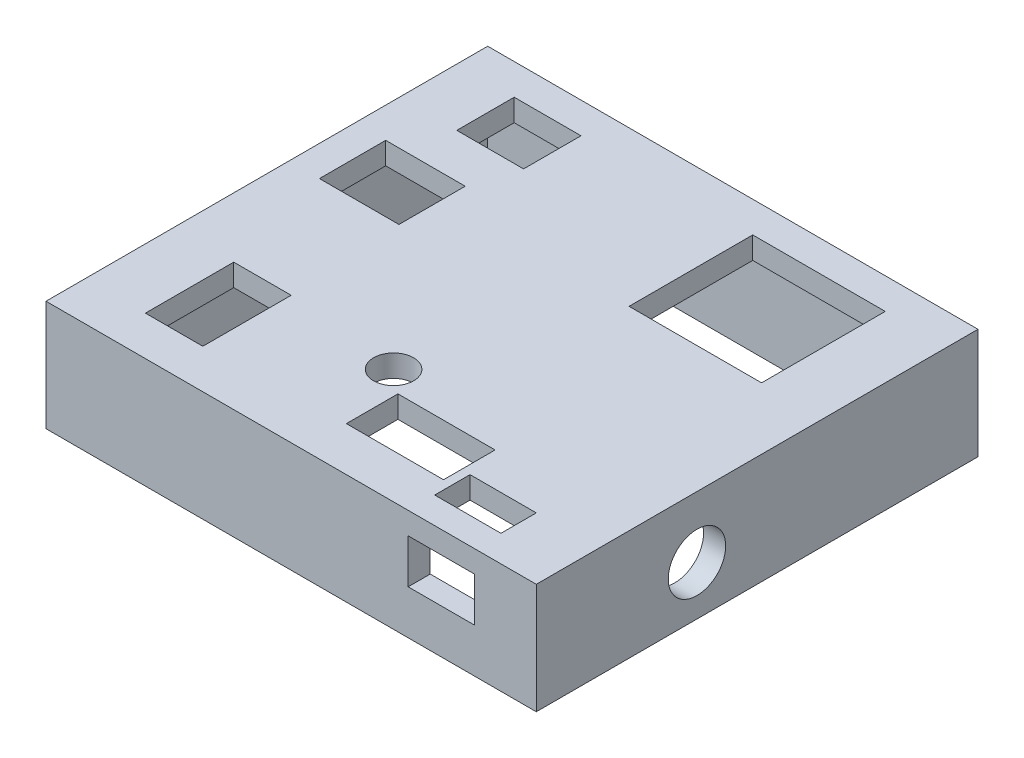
SolidWorks part; units mm, degrees
ref_plane "Front Plane" through (0, 0, 0) normal (0, 0, 1) x (1, 0, 0)
ref_plane "Top Plane" through (0, 0, 0) normal (0, 1, 0) x (1, 0, 0)
ref_plane "Right Plane" through (0, 0, 0) normal (1, 0, 0) x (0, 0, -1)
sketch "Sketch1" plane through (0, 0, 0) normal (0, 1, 0) x (1, 0, 0)
  line L1 (-97.8483, 41.8697) -> (13.1517, 41.8697)
  line L2 (-97.8483, 41.8697) -> (-97.8483, -58.1303)
  line L3 (-97.8483, -58.1303) -> (13.1517, -58.1303)
  line L4 (13.1517, 41.8697) -> (13.1517, -58.1303)
  dimension "D1" = 100
  dimension "D2" = 111
extrude "Boss-Extrude1" add sketch "Sketch1" along normal blind 25 contours L2 L3 L4 L1
sketch "Sketch2" plane through (0, 0, 0) normal (0, -1, 0) x (1, 0, 0)
  line L1 (-92.8483, 53.1303) -> (8.1517, 53.1303)
  line L2 (-92.8483, 53.1303) -> (-92.8483, -36.8697)
  line L3 (-92.8483, -36.8697) -> (8.1517, -36.8697)
  line L4 (8.1517, 53.1303) -> (8.1517, -36.8697)
  line L5 (-97.8483, -41.8697) -> (13.1517, -41.8697) construction
  line L6 (-97.8483, 58.1303) -> (13.1517, 58.1303) construction
  line L7 (-97.8483, -41.8697) -> (-97.8483, 58.1303) construction
  dimension "D1" = 90
  dimension "D2" = 101
  dimension "D3" = 5
  dimension "D4" = 5
  dimension "D5" = 5
extrude "Cut-Extrude1" cut sketch "Sketch2" against normal blind 20
sketch "Sketch3" plane through (0, 20, 0) normal (0, -1, 0) x (1, 0, 0)
  line L0 (-17.8483, 53.1303) -> (-17.8483, -6.928) construction
  line L1 (8.1517, 53.1303) -> (-92.8483, 53.1303) construction
  line L2 (8.1517, -36.8697) -> (8.1517, 53.1303) construction
  line L3 (-78.5725, 48.1303) -> (21.6758, 48.1303) construction
  line L5 (-17.8483, 48.1303) -> (-39.8483, 48.1303)
  line L6 (-17.8483, 48.1303) -> (-17.8483, 36.4579)
  line L7 (-17.8483, 36.4579) -> (-39.8483, 36.4579)
  line L8 (-39.8483, 48.1303) -> (-39.8483, 36.4579)
  point P4 (-17.8483, 23.1012)
  dimension "D1" = 26
  dimension "D2" = 5
  dimension "D3" = 11.6724
  dimension "D4" = 22
extrude "Cut-Extrude2" cut sketch "Sketch3" against normal blind 20
sketch "Sketch4" plane through (0, 20, 0) normal (0, -1, 0) x (1, 0, 0)
  line L0 (-0.8483, 56.7224) -> (-0.8483, 29.633) construction
  line L1 (8.1517, -36.8697) -> (8.1517, 53.1303) construction
  line L2 (-19.3423, 52.1303) -> (3.7812, 52.1303) construction
  line L3 (8.1517, 53.1303) -> (-92.8483, 53.1303) construction
  line L5 (-0.8483, 52.1303) -> (-15.8483, 52.1303)
  line L6 (-0.8483, 52.1303) -> (-0.8483, 44.1303)
  line L7 (-0.8483, 44.1303) -> (-15.8483, 44.1303)
  line L8 (-15.8483, 52.1303) -> (-15.8483, 44.1303)
  dimension "D1" = 9
  dimension "D2" = 1
  dimension "D3" = 15
  dimension "D4" = 8
extrude "Cut-Extrude3" cut sketch "Sketch4" against normal blind 20 contours L7 L8 L5 L6
sketch "Sketch5" plane through (0, 20, 0) normal (0, -1, 0) x (-1, 0, 0)
  line L0 (107.5468, 11.8697) -> (42.1706, 11.8697) construction
  line L1 (92.8483, 36.8697) -> (-8.1517, 36.8697) construction
  line L2 (82.55, -10.5214) -> (82.55, 45.7651) construction
  line L4 (90.9405, 11.8697) -> (72.9405, 11.8697)
  line L5 (90.9405, 11.8697) -> (90.9405, -3.1303)
  line L6 (90.9405, -3.1303) -> (72.9405, -3.1303)
  line L7 (72.9405, 11.8697) -> (72.9405, -3.1303)
  dimension "D1" = 25
  dimension "D2" = 15
  dimension "D3" = 18
extrude "Cut-Extrude4" cut sketch "Sketch5" against normal blind 20
sketch "Sketch6" plane through (0, 20, 0) normal (0, -1, 0) x (1, 0, 0)
  line L0 (-105.53, -34.8697) -> (-50.562, -34.8697) construction
  line L1 (-84.8483, -48.4173) -> (-84.8483, 21.0826) construction
  line L2 (-92.8483, -36.8697) -> (8.1517, -36.8697) construction
  line L3 (-92.8483, 53.1303) -> (-92.8483, -36.8697) construction
  line L5 (-84.8483, -34.8697) -> (-69.7271, -34.8697)
  line L6 (-84.8483, -34.8697) -> (-84.8483, -21.8697)
  line L7 (-84.8483, -21.8697) -> (-69.7271, -21.8697)
  line L8 (-69.7271, -34.8697) -> (-69.7271, -21.8697)
  dimension "D1" = 2
  dimension "D2" = 8
  dimension "D3" = 13
extrude "Cut-Extrude5" cut sketch "Sketch6" against normal blind 20
sketch "Sketch7" plane through (0, 20, 0) normal (0, -1, 0) x (-1, 0, 0)
  line L0 (0.8483, -8.0589) -> (0.8483, 53.6115) construction
  line L3 (-8.1517, 36.8697) -> (-8.1517, -53.1303) construction
  line L4 (37.8962, 34.8697) -> (-42.6529, 34.8697) construction
  line L5 (92.8483, 36.8697) -> (-8.1517, 36.8697) construction
  line L7 (0.8483, 34.8697) -> (30.8483, 34.8697)
  line L8 (0.8483, 34.8697) -> (0.8483, 6.8697)
  line L9 (0.8483, 6.8697) -> (30.8483, 6.8697)
  line L10 (30.8483, 34.8697) -> (30.8483, 6.8697)
  dimension "D1" = 9
  dimension "D2" = 2
  dimension "D3" = 28
  dimension "D4" = 30
extrude "Cut-Extrude6" cut sketch "Sketch7" against normal blind 20
sketch "Sketch8" plane through (0, 20, 0) normal (0, -1, 0) x (1, 0, 0)
  line L0 (-39.8483, 24.7514) -> (-39.8483, -48.4264) construction
  line L1 (8.1517, -36.8697) -> (8.1517, 53.1303) construction
  line L2 (-122.3955, 32.1303) -> (27.19, 32.1303) construction
  line L3 (8.1517, 53.1303) -> (-92.8483, 53.1303) construction
  circle A0 centre (-45.1557, 32.1303) radius 4.5337
  dimension "D1" = 48
  dimension "D2" = 21
extrude "Cut-Extrude7" cut sketch "Sketch8" against normal blind 20
sketch "Sketch9" plane through (0, 20, 0) normal (0, -1, 0) x (1, 0, 0)
  line L1 (-84.2613, 49.2145) -> (-71.2613, 49.2145)
  line L2 (-84.2613, 49.2145) -> (-84.2613, 29.2145)
  line L3 (-84.2613, 29.2145) -> (-71.2613, 29.2145)
  line L4 (-71.2613, 49.2145) -> (-71.2613, 29.2145)
  point P4 (0, 0)
  dimension "D1" = 20
  dimension "D2" = 13
extrude "Cut-Extrude8" cut sketch "Sketch9" against normal blind 20 contours L4 L3 L2 L1
sketch "Sketch10" plane through (13.1517, 0, 0) normal (1, 0, 0) x (0, 0, -1)
  circle A0 centre (-21.7583, 11.1015) radius 6.5
  dimension "D1" = 13
extrude "Cut-Extrude10" cut sketch "Sketch10" against normal blind 20
sketch "Sketch11" plane through (0, 0, 53.1303) normal (0, 0, -1) x (-1, 0, 0)
  line L0 (-8.1517, 20) -> (92.8483, 20) construction
  line L1 (0.8341, 20) -> (15.8569, 20)
  line L2 (0.8341, 20) -> (0.8341, 10)
  line L3 (0.8341, 10) -> (15.8569, 10)
  line L4 (15.8569, 20) -> (15.8569, 10)
  dimension "D1" = 10
extrude "Cut-Extrude11" cut sketch "Sketch11" against normal blind 20
